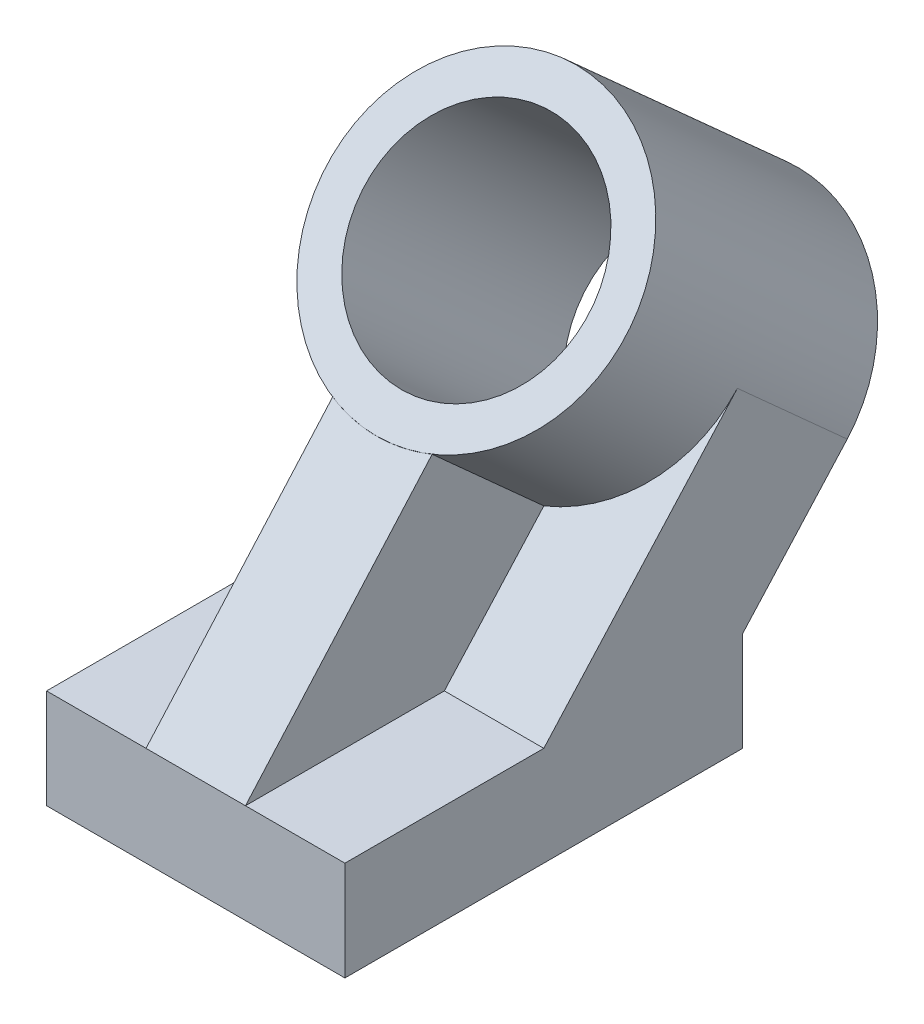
SolidWorks part; units mm, degrees
ref_plane "Front Plane" through (0, 0, 0) normal (0, 0, 1) x (1, 0, 0)
ref_plane "Top Plane" through (0, 0, 0) normal (0, 1, 0) x (1, 0, 0)
ref_plane "Right Plane" through (0, 0, 0) normal (1, 0, 0) x (0, 0, -1)
sketch "Sketch1" plane through (0, 0, 0) normal (1, 0, 0) x (0, 0, -1)
  line L0 (0, 0) -> (0, 25.4)
  line L1 (0, 25.4) -> (50.8, 25.4)
  line L2 (50.8, 25.4) -> (100.2446, 80.3137)
  line L3 (100.2446, 80.3137) -> (128.2996, 55.0529)
  line L4 (128.2996, 55.0529) -> (101.6, 25.4)
  line L5 (101.6, 25.4) -> (101.6, 0)
  line L6 (101.6, 0) -> (0, 0)
  dimension "D1" = 25.4
  dimension "D2" = 50.8
  dimension "D3" = 101.6
  dimension "D4" = 48
  dimension "D5" = 114.3
extrude "Boss-Extrude1" add sketch "Sketch1" along normal mid plane 76.2
sketch "Sketch3" plane through (0, -39.1492, -43.4796) normal (0, -0.6691, -0.7431) x (-1, 0, 0)
  line L0 (-38.1, 126.7614) -> (38.1, 126.7614) construction
  circle A0 centre (0, 126.7614) radius 38.1
extrude "Boss-Extrude2" add sketch "Sketch3" against normal blind 76.2
sketch "Sketch4" plane through (0, 11.8385, 13.148) normal (0, 0.6691, 0.7431) x (1, 0, 0)
  circle A0 centre (0, 126.7614) radius 28.575
  dimension "D1" = 57.15
extrude "Cut-Extrude1" cut sketch "Sketch4" against normal through all
ref_plane "Plane2" through (0, 0, 0) normal (-1, 0, 0) x (0, 0, 1)
sketch "Sketch9" plane through (0, 0, 0) normal (-1, 0, 0) x (0, 0, 1)
  line L0 (-52.5515, 84.8053) -> (0, 25.4)
  line L4 (-46.1781, 77.7268) -> (-97.1658, 134.3545) construction
rib "Rib23" sketch "Sketch9" sketch "Sketch9" thickness 25.4 extrusion direction parallel to sketch draft on no parameters "D1"=25.4
